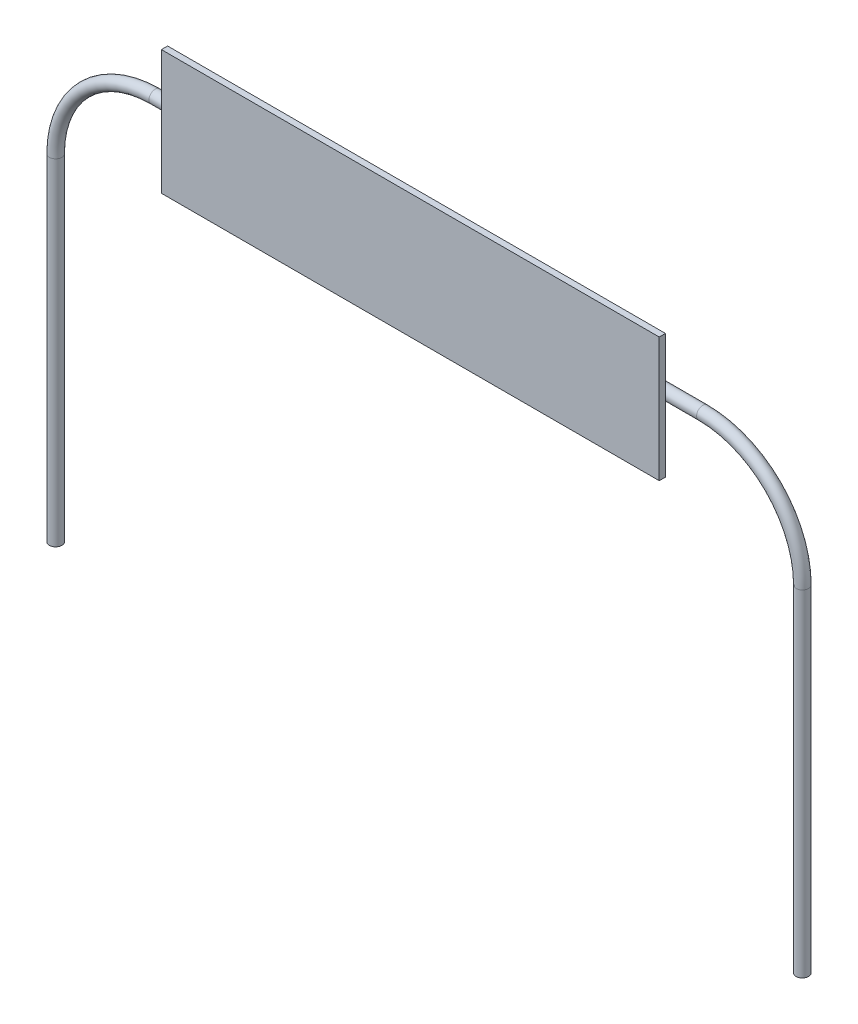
SolidWorks part; units mm, degrees
ref_plane "Front Plane"
ref_plane "Top Plane" through (0, 0, 0) normal (0, 1, 0) x (1, 0, 0)
ref_plane "Right Plane"
sketch "Sketch1" plane through (0, 0, 0) normal (0, 0, 1) x (1, 0, 0)
  line L1 (-6096, -1524) -> (6096, -1524)
  line L2 (-6096, -1524) -> (-6096, 1524)
  line L3 (-6096, 1524) -> (6096, 1524)
  line L4 (6096, -1524) -> (6096, 1524)
  line L5 (-6096, -1524) -> (6096, 1524) construction
  line L6 (-6096, 1524) -> (6096, -1524) construction
  point P0 (0, 0)
  dimension "D1" = 12192
  dimension "D2" = 3048
extrude "Boss-Extrude1" add sketch "Sketch1" along normal blind 152.4 from offset 304.8
sketch "Sketch2" plane through (0, 0, 0) normal (0, 0, 1) x (1, 0, 0)
  line L0 (0, 0) -> (0, -5485.6807) construction
  line L1 (-6705.6, 0) -> (6705.6, 0)
  line L2 (-9144, -2438.4) -> (-9144, -10668)
  line L4 (9144, -2438.4) -> (9144, -10668)
  arc A0 (6705.6, 0) -> (9144, -2438.4) centre (6705.6, -2438.4) cw
  arc A1 (-6705.6, 0) -> (-9144, -2438.4) centre (-6705.6, -2438.4) ccw
  point P9 (9144, 0)
  point P12 (-9144, 0)
  dimension "D3" = 2438.4
  dimension "D1" = 18288
  dimension "D2" = 10668
ref_plane "Plane1" through (0, -10668, 0) normal (0, 1, 0) x (-1, 0, 0)
sketch "Sketch4" plane through (0, -10668, 0) normal (0, 1, 0) x (-1, 0, 0)
  circle A0 centre (-9144, 0) radius 152.4
  dimension "D1" = 304.8
sweep "Sweep2" add profiles "Sketch4" path "Sketch2"
sketch "Sketch5" plane through (0, 0, 0) normal (1, 0, 0) x (0, 0, -1)
  line L0 (0, 152.4) -> (-182.88, 152.4)
  line L1 (-304.8, -1524) -> (-304.8, 1524) construction
  line L2 (0, -152.4) -> (-30.48, -152.4)
  line L3 (-152.4, 0) -> (-152.4, -2438.4) construction
  line L4 (-304.8, 274.32) -> (-304.8, 457.2)
  line L5 (-152.4, -274.32) -> (-152.4, -457.2)
  line L6 (-152.4, 0) -> (-152.4, -2438.4) construction
  line L7 (-60.96, -274.32) -> (-60.96, -457.2)
  line L8 (0, -243.84) -> (-30.48, -243.84)
  line L9 (0, 243.84) -> (-182.88, 243.84)
  line L10 (-213.36, 274.32) -> (-213.36, 457.2)
  line L11 (-213.36, 457.2) -> (-304.8, 457.2)
  line L12 (-60.96, -457.2) -> (-152.4, -457.2)
  circle A0 centre (0, 0) radius 152.4 construction
  arc A1 (0, -152.4) -> (0, 152.4) centre (0, 0) ccw
  arc A2 (-30.48, -152.4) -> (-152.4, -274.32) centre (-30.48, -274.32) ccw
  arc A3 (-182.88, 152.4) -> (-304.8, 274.32) centre (-182.88, 274.32) cw
  arc A4 (-30.48, -243.84) -> (-60.96, -274.32) centre (-30.48, -274.32) ccw
  arc A5 (0, -243.84) -> (0, 243.84) centre (0, 0) ccw
  arc A6 (-182.88, 243.84) -> (-213.36, 274.32) centre (-182.88, 274.32) cw
  point P16 (-152.4, -152.4)
  point P19 (-304.8, 152.4)
  dimension "D2" = 121.92
  dimension "D1" = 304.8
  dimension "D3" = 91.44
extrude "Boss-Extrude4" add sketch "Sketch5" along normal blind 457.2 from offset 2438.4 separate body
mirror "Mirror1"
